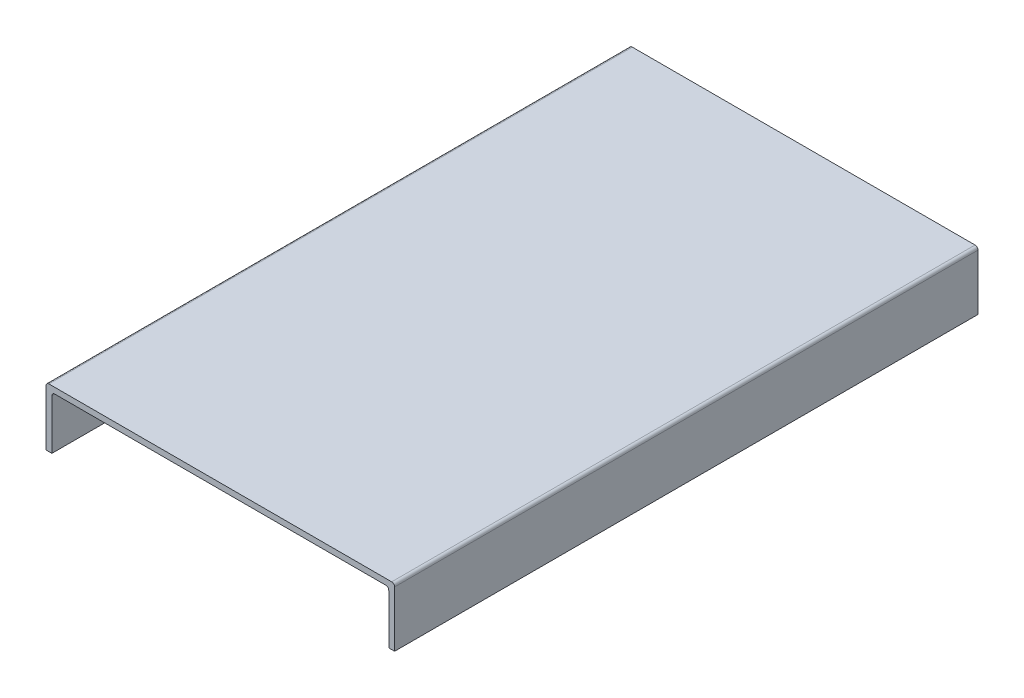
SolidWorks part; units mm, degrees
ref_plane "Plan de face" through (0, 0, 0) normal (0, 0, 1) x (1, 0, 0)
ref_plane "Plan de dessus" through (0, 0, 0) normal (0, 1, 0) x (1, 0, 0)
ref_plane "Plan de droite" through (0, 0, 0) normal (1, 0, 0) x (0, 0, -1)
sketch "Esquisse1" plane through (0, 0, 0) normal (0, 0, 1) x (1, 0, 0)
  line L0 (0, 0) -> (0, 50)
  line L1 (0, 50) -> (297, 50)
  line L2 (297, 50) -> (297, 0)
extrude "Extru.-Mince1" add sketch "Esquisse1" along normal blind 497 thin
fillet "Congé1" radius 2.5 1 edges at (297, 50, 248.5)
fillet "Congé2" radius 2.5 1 edges at (0, 50, 248.5)
fillet "Congé3" radius 2.5 1 edges at (292, 45, 248.5)
fillet "Congé4" radius 2.5 1 edges at (5, 45, 248.5)
